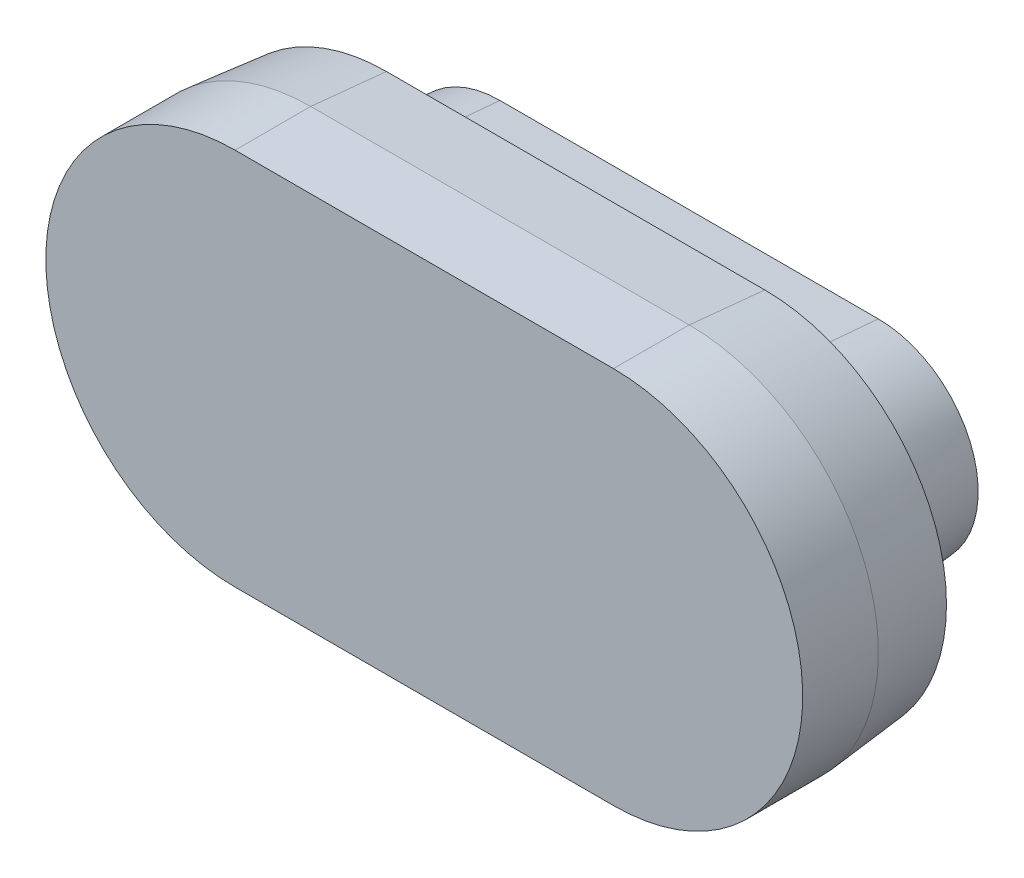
SolidWorks part; units mm, degrees
ref_plane "Plan de face" through (0, 0, 0) normal (0, 0, 1) x (1, 0, 0)
ref_plane "Plan de dessus" through (0, 0, 0) normal (0, 1, 0) x (1, 0, 0)
ref_plane "Plan de droite" through (0, 0, 0) normal (1, 0, 0) x (0, 0, -1)
sketch "Esquisse1" plane through (0, 0, 0) normal (0, 0, 1) x (1, 0, 0)
  line L0 (0, 0) -> (5, 0) construction
  line L1 (0, 2.5) -> (5, 2.5)
  line L2 (0, -2.5) -> (5, -2.5)
  arc A0 (0, 2.5) -> (0, -2.5) centre (0, 0) ccw
  arc A1 (5, -2.5) -> (5, 2.5) centre (5, 0) ccw
  point P3 (2.5, 0)
  dimension "D1" = 5
  dimension "D2" = 5
extrude "Boss.-Extru.1" add sketch "Esquisse1" along normal blind 2
sketch "Esquisse2" plane through (0, 0, 0) normal (0, 0, -1) x (-1, 0, 0)
  line L0 (-5.3054, 0) -> (0, 0) construction
  line L1 (-2.5, 2.5) -> (-2.5, -2.5) construction
  line L2 (-5, 2.5) -> (0, 2.5) construction
  line L3 (0, -2.5) -> (-5, -2.5) construction
sketch "Esquisse3" plane through (0, 0, 0) normal (0, 0, -1) x (-1, 0, 0)
  line L0 (-2.5, 2.5) -> (-2.5, -2.5) construction
  line L3 (-5, 1.45) -> (0, 1.45)
  line L4 (-5, -1.45) -> (0, -1.45)
  arc A3 (-5, 2.5) -> (-5, -2.5) centre (-5, 0) ccw construction
  arc A4 (-5, 2.5) -> (-5, -2.5) centre (-5, 0) ccw construction
  arc A5 (-5, 1.45) -> (-5, -1.45) centre (-5, 0) ccw
  arc A6 (0, 1.45) -> (0, -1.45) centre (0, 0) cw
  dimension "D1" = 2.9
extrude "Boss.-Extru.2" add sketch "Esquisse3" along normal blind 1.5
draft "Dépouille7" type of draft neutral plane draft angle 5 faces to draft 2 parameters "D1"=5
draft "Dépouille8" type of draft neutral plane draft angle 5 faces to draft 2 parameters "D1"=5
sketch "Esquisse4" plane through (0, 0, -1.5) normal (0, 0, -1) x (-1, 0, 0)
  line L4 (-5, -0.5188) -> (0, -0.5188)
  line L5 (0, 0.5188) -> (-5, 0.5188)
  line L6 (-5, -0.5188) -> (0, -0.5188)
  line L7 (0, 0.5188) -> (-5, 0.5188)
  arc A4 (-5, 0.5188) -> (-5, -0.5188) centre (-5, 0) ccw
  arc A5 (0, -0.5188) -> (0, 0.5188) centre (0, 0) ccw
  arc A6 (-5, 0.5188) -> (-5, -0.5188) centre (-5, 0) ccw
  arc A7 (0, -0.5188) -> (0, 0.5188) centre (0, 0) ccw
  dimension "D1" = 0.8
extrude "Enlèv. mat.-Extru.1" cut sketch "Esquisse4" against normal blind 2.5
chamfer "Chanfrein1" distance 0.4 distance2 4 4 edges at (2.5, -0.5188, -1.5) (-0.5188, 0, -1.5) (5.5188, 0, -1.5) (2.5, 0.5188, -1.5)
fillet "Congé1" radius 0.5 4 edges at (2.5, 0.6688, 1) (-0.6688, 0, 1) (2.5, -0.6688, 1) (5.6688, 0, 1)
chamfer "Chanfrein2" distance 0.1 distance2 1 4 edges at (-2.5, 0, 0) (2.5, -2.5, 0) (2.5, 2.5, 0) (7.5, 0, 0)
